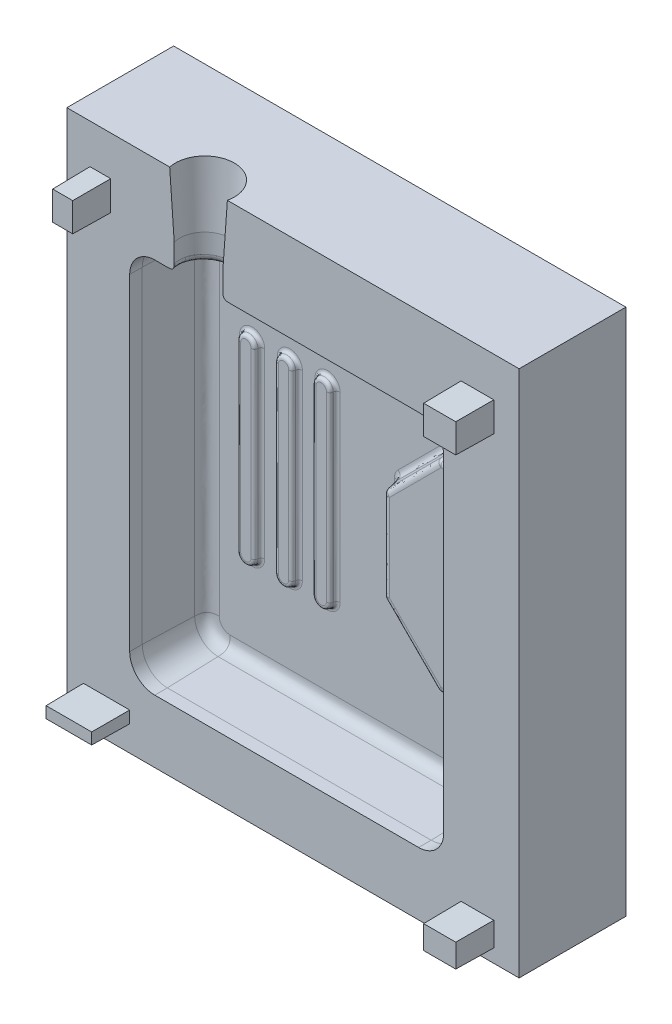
SolidWorks part; units mm, degrees
ref_plane "Front Plane" through (0, 0, 0) normal (0, 0, 1) x (1, 0, 0)
ref_plane "Top Plane" through (0, 0, 0) normal (0, 1, 0) x (1, 0, 0)
ref_plane "Right Plane" through (0, 0, 0) normal (1, 0, 0) x (0, 0, -1)
sketch "Sketch1" plane through (0, 0, 0) normal (0, 0, 1) x (1, 0, 0)
  line L1 (0, 0) -> (250, 0)
  line L2 (0, 0) -> (0, 300)
  line L3 (0, 300) -> (250, 300)
  line L4 (250, 0) -> (250, 300)
  dimension "D1" = 250
  dimension "D2" = 300
sketch "Sketch2" plane through (0, 0, 0) normal (0, 0, 1) x (1, 0, 0)
  line L0 (0, 280) -> (0, 20)
  line L1 (20, 0) -> (230, 0)
  line L2 (250, 20) -> (250, 280)
  line L3 (230, 300) -> (70, 300)
  line L4 (35, 300) -> (35, 320)
  line L5 (35, 320) -> (70, 320)
  line L6 (70, 320) -> (70, 300)
  line L8 (215, 67.5) -> (200, 67.5)
  line L9 (200, 67.5) -> (155, 112.5)
  line L10 (155, 112.5) -> (155, 187.5)
  line L11 (155, 187.5) -> (200, 232.5)
  line L12 (200, 232.5) -> (215, 232.5)
  line L13 (215, 150) -> (155, 150) construction
  line L14 (215, 232.5) -> (215, 67.5)
  line L15 (35, 300) -> (20, 300)
  arc A0 (0, 20) -> (20, 0) centre (20, 20) ccw
  arc A1 (230, 0) -> (250, 20) centre (230, 20) ccw
  arc A2 (250, 280) -> (230, 300) centre (230, 280) ccw
  arc A3 (0, 280) -> (20, 300) centre (20, 280) cw
  point P10 (0, 0)
  point P13 (250, 0)
  point P16 (250, 300)
  point P19 (0, 300)
  point P34 (250, 150)
  dimension "D1" = 20
  dimension "D2" = 35
  dimension "D3" = 165
  dimension "D4" = 15
  dimension "D5" = 60
  dimension "D6" = 35
  dimension "D7" = 20
  dimension "D8" = 15
sketch "Sketch3" plane through (0, 0, 0) normal (0, 0, 1) x (1, 0, 0)
  line L0 (230, 300) -> (70, 300) construction
  line L4 (35, 300) -> (20, 300) construction
  line L5 (0, 280) -> (0, 20) construction
  line L6 (20, 0) -> (230, 0) construction
  line L7 (250, 20) -> (250, 280) construction
  line L8 (230, 300) -> (70, 300)
  line L12 (70, 300) -> (20, 300)
  line L13 (0, 280) -> (0, 20)
  line L14 (20, 0) -> (230, 0)
  line L15 (250, 20) -> (250, 280)
  arc A0 (20, 300) -> (0, 280) centre (20, 280) ccw construction
  arc A1 (0, 20) -> (20, 0) centre (20, 20) ccw construction
  arc A2 (230, 0) -> (250, 20) centre (230, 20) ccw construction
  arc A3 (250, 280) -> (230, 300) centre (230, 280) ccw construction
  arc A4 (20, 300) -> (0, 280) centre (20, 280) ccw
  arc A5 (0, 20) -> (20, 0) centre (20, 20) ccw
  arc A6 (230, 0) -> (250, 20) centre (230, 20) ccw
  arc A7 (250, 280) -> (230, 300) centre (230, 280) ccw
extrude "Boss-Extrude1" add sketch "Sketch3" along normal blind 50 draft 2
sketch "Sketch4" plane through (0, 0, 50) normal (0, 0, 1) x (1, 0, 0)
  line L0 (215, 232.5) -> (215, 67.5) construction
  line L1 (215, 67.5) -> (200, 67.5) construction
  line L2 (200, 67.5) -> (155, 112.5) construction
  line L3 (155, 112.5) -> (155, 187.5) construction
  line L4 (155, 187.5) -> (200, 232.5) construction
  line L5 (200, 232.5) -> (215, 232.5) construction
  line L6 (215, 232.5) -> (215, 67.5)
  line L7 (215, 67.5) -> (200, 67.5)
  line L8 (200, 67.5) -> (155, 112.5)
  line L9 (155, 112.5) -> (155, 187.5)
  line L10 (155, 187.5) -> (200, 232.5)
  line L11 (200, 232.5) -> (215, 232.5)
extrude "Cut-Extrude1" cut sketch "Sketch4" against normal blind 15 draft 10
sketch "Sketch5" plane through (0, 0, 50) normal (0, 0, 1) x (1, 0, 0)
  line L0 (37.5, 222.5) -> (37.5, 77.5) construction
  line L1 (45, 222.5) -> (45, 77.5)
  line L2 (30, 222.5) -> (30, 77.5)
  line L4 (37.5, 150) -> (142.9758, 150) construction
  line L5 (67.5, 222.5) -> (67.5, 77.5) construction
  line L6 (75, 222.5) -> (75, 77.5)
  line L7 (60, 222.5) -> (60, 77.5)
  line L8 (97.5, 222.5) -> (97.5, 77.5) construction
  line L9 (105, 222.5) -> (105, 77.5)
  line L10 (90, 222.5) -> (90, 77.5)
  arc A0 (45, 222.5) -> (30, 222.5) centre (37.5, 222.5) ccw
  arc A1 (30, 77.5) -> (45, 77.5) centre (37.5, 77.5) ccw
  arc A2 (75, 222.5) -> (60, 222.5) centre (67.5, 222.5) ccw
  arc A3 (60, 77.5) -> (75, 77.5) centre (67.5, 77.5) ccw
  arc A4 (105, 222.5) -> (90, 222.5) centre (97.5, 222.5) ccw
  arc A5 (90, 77.5) -> (105, 77.5) centre (97.5, 77.5) ccw
  point P2 (37.5, 150)
  point P15 (67.5, 150)
  point P22 (97.5, 150)
  dimension "D1" = 15
  dimension "D2" = 145
  dimension "D3" = 30
  dimension "D4" = 3
extrude "Cut-Extrude2" cut sketch "Sketch5" against normal blind 5 draft 10
fillet "Fillet1" radius 10 8 edges at (242.9075, 292.9075, 50) (248.254, 150, 50) (242.9075, 7.0925, 50) (125, 1.746, 50) (7.0925, 7.0925, 50) (1.746, 150, 50) (7.0925, 292.9075, 50) (125, 298.254, 50)
sketch "Sketch6" plane through (0, 0, 0) normal (0, 0, -1) x (-1, 0, 0)
  line L4 (-250, 280) -> (-250, 20)
  line L5 (-230, 0) -> (-20, 0)
  line L6 (0, 20) -> (0, 280)
  line L7 (-20, 300) -> (-230, 300)
  line L8 (-250, 280) -> (-250, 20)
  line L9 (-230, 0) -> (-20, 0)
  line L10 (0, 20) -> (0, 280)
  line L11 (-20, 300) -> (-230, 300)
  arc A4 (-230, 300) -> (-250, 280) centre (-230, 280) ccw
  arc A5 (-250, 20) -> (-230, 0) centre (-230, 20) ccw
  arc A6 (-20, 0) -> (0, 20) centre (-20, 20) ccw
  arc A7 (0, 280) -> (-20, 300) centre (-20, 280) ccw
  arc A8 (-230, 300) -> (-250, 280) centre (-230, 280) ccw
  arc A9 (-250, 20) -> (-230, 0) centre (-230, 20) ccw
  arc A10 (-20, 0) -> (0, 20) centre (-20, 20) ccw
  arc A11 (0, 280) -> (-20, 300) centre (-20, 280) ccw
  dimension "D1" = 0
extrude "Boss-Extrude2" add sketch "Sketch6" along normal blind 5
fillet "Fillet2" radius 5 18 edges at (155, 150, 50) (177.5, 90, 50) (177.5, 210, 50) (207.5, 67.5, 50) (207.5, 232.5, 50) (212.3551, 150, 35) (206.7253, 70.1449, 35) (179.3702, 91.8702, 35) (157.6449, 150, 35) (179.3702, 208.1298, 35) (206.7253, 229.8551, 35) (215, 150, 50) (200.5478, 231.1775, 42.5) (156.3225, 113.0478, 42.5) (200.5478, 68.8225, 42.5) (213.6775, 68.8225, 42.5) (213.6775, 231.1775, 42.5) (156.3225, 186.9522, 42.5)
fillet "Fillet3" radius 3 24 edges at (37.5, 70, 50) (30, 150, 50) (37.5, 230, 50) (67.5, 70, 50) (60, 150, 50) (67.5, 230, 50) (97.5, 70, 50) (90, 150, 50) (97.5, 230, 50) (45, 150, 50) (75, 150, 50) (97.5, 229.1184, 45) (90.8816, 150, 45) (97.5, 70.8816, 45) (67.5, 229.1184, 45) (60.8816, 150, 45) (67.5, 70.8816, 45) (37.5, 229.1184, 45) (30.8816, 150, 45) (37.5, 70.8816, 45) (44.1184, 150, 45) (74.1184, 150, 45) (105, 150, 50) (104.1184, 150, 45)
mirror "Mirror1" about plane through (230, 280, -5) normal (0, 0, -1)
sketch "Sketch7" plane through (0, 300, 0) normal (0, 1, 0) x (1, 0, 0)
  circle A0 centre (54.8055, 5) radius 20
  dimension "D1" = 40
  dimension "D2" = 5
  dimension "D3" = 54.8055
extrude "Boss-Extrude3" add sketch "Sketch7" along normal mid plane 40
fillet "Fillet4" radius 5 4 edges at (34.8055, 300, -5) (54.8055, 299.4762, 15) (74.8055, 300, -5) (54.8055, 299.4762, -25)
shell "Shell1" thickness 4
sketch "Sketch10" plane through (0, 320, 0) normal (0, 1, 0) x (1, 0, 0)
  circle A1 centre (54.8055, 5) radius 20
  circle A3 centre (54.8055, 5) radius 20
  dimension "D1" = 0
extrude "Boss-Extrude6" add sketch "Sketch10" along normal blind 80 draft 4
sketch "Sketch8" plane through (0, 0, 0) normal (0, 0, 1) x (1, 0, 0)
  line L1 (-50, -50) -> (310, -50)
  line L2 (-50, -50) -> (-50, 370)
  line L3 (-50, 370) -> (310, 370)
  line L4 (310, -50) -> (310, 370)
  dimension "D1" = 50
  dimension "D2" = 50
  dimension "D3" = 360
  dimension "D4" = 420
extrude "Boss-Extrude4" add sketch "Sketch8" against normal blind 85 separate body
sketch "Sketch9" plane through (0, 0, 0) normal (0, 0, 1) x (1, 0, 0)
  line L1 (-31.5724, 338.5114) -> (-15.0677, 338.5114)
  line L2 (-31.5724, 338.5114) -> (-31.5724, 315.0573)
  line L3 (-31.5724, 315.0573) -> (-15.0677, 315.0573)
  line L4 (-15.0677, 338.5114) -> (-15.0677, 315.0573)
  line L5 (263.775, 338.5114) -> (289.835, 338.5114)
  line L6 (263.775, 338.5114) -> (263.775, 315.0573)
  line L7 (263.775, 315.0573) -> (289.835, 315.0573)
  line L8 (289.835, 338.5114) -> (289.835, 315.0573)
  line L9 (263.775, -20.2487) -> (289.835, -20.2487)
  line L10 (263.775, -20.2487) -> (263.775, -39.3594)
  line L11 (263.775, -39.3594) -> (289.835, -39.3594)
  line L12 (289.835, -20.2487) -> (289.835, -39.3594)
  line L13 (0, -29.8041) -> (-36.7844, -29.8041)
  line L14 (0, -29.8041) -> (0, -20.2487)
  line L15 (0, -20.2487) -> (-36.7844, -20.2487)
  line L16 (-36.7844, -29.8041) -> (-36.7844, -20.2487)
extrude "Boss-Extrude5" add sketch "Sketch9" along normal blind 30 draft 0.5
combine bodies "Combine3" operation type subtract main body 108 bodies to subtract 110
